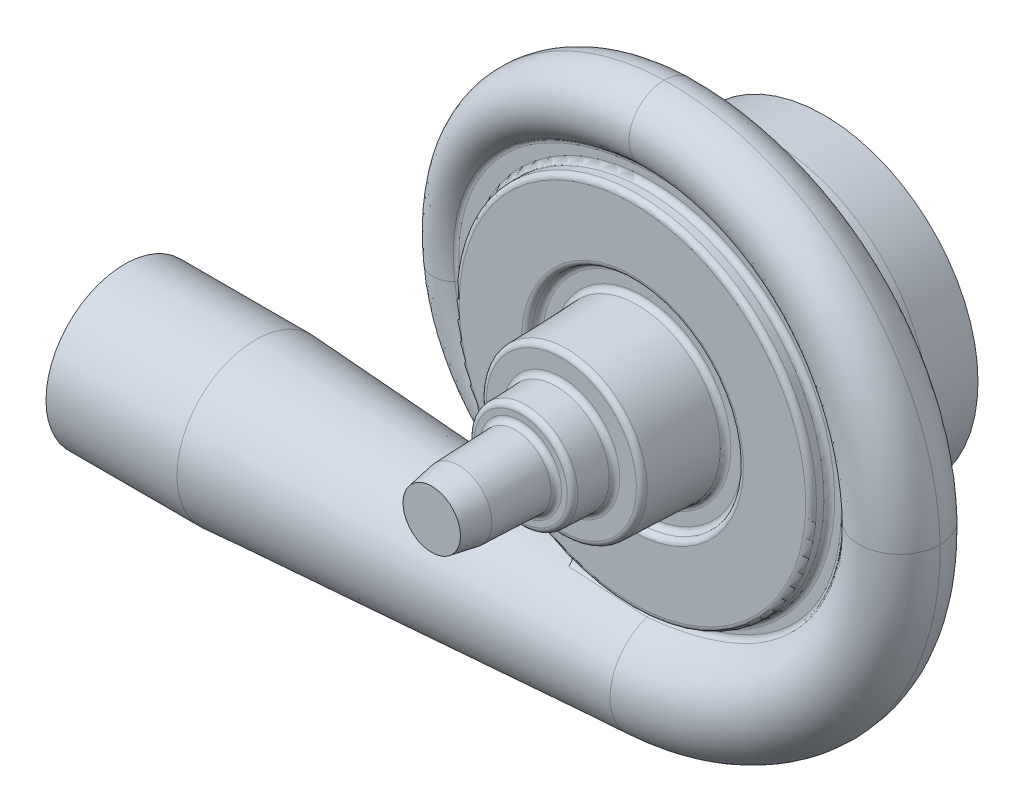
SolidWorks part; units mm, degrees
ref_plane "Plan de face" through (0, 0, 0) normal (0, 0, 1) x (1, 0, 0)
ref_plane "Plan de dessus" through (0, 0, 0) normal (0, 1, 0) x (1, 0, 0)
ref_plane "Plan de droite" through (0, 0, 0) normal (1, 0, 0) x (0, 0, -1)
surface "Surface-Cousue1"
surface "Surface-Plan1"
surface "Surface-Plan2"
surface "Surface-Plan3"
surface "Surface-Cousue2"
sketch "Esquisse2" plane through (-152.9114, 0, 0) normal (-1, 0, 0) x (0, 0, 1)
  circle A0 centre (0, -91.1392) radius 29.3671 construction
  circle A1 centre (0, -91.1392) radius 29.3671
extrude "Extrusion1" add sketch "Esquisse2" along normal blind 49
sketch "Esquisse3" plane through (0, 0, 76.962) normal (0, 0, 1) x (1, 0, 0)
  circle A0 centre (0, 0) radius 12.5023 construction
  circle A1 centre (0, 0) radius 12.5023
extrude "Extrusion2" add sketch "Esquisse3" along normal blind 10 draft 10
sketch "Esquisse4" plane through (0, 0, -39.7829) normal (0, 0, -1) x (-1, 0, 0)
  circle A0 centre (0, 0) radius 59.3702 construction
  circle A1 centre (0, 0) radius 59.3702
extrude "Extrusion3" add sketch "Esquisse4" along normal blind 20 draft 5
